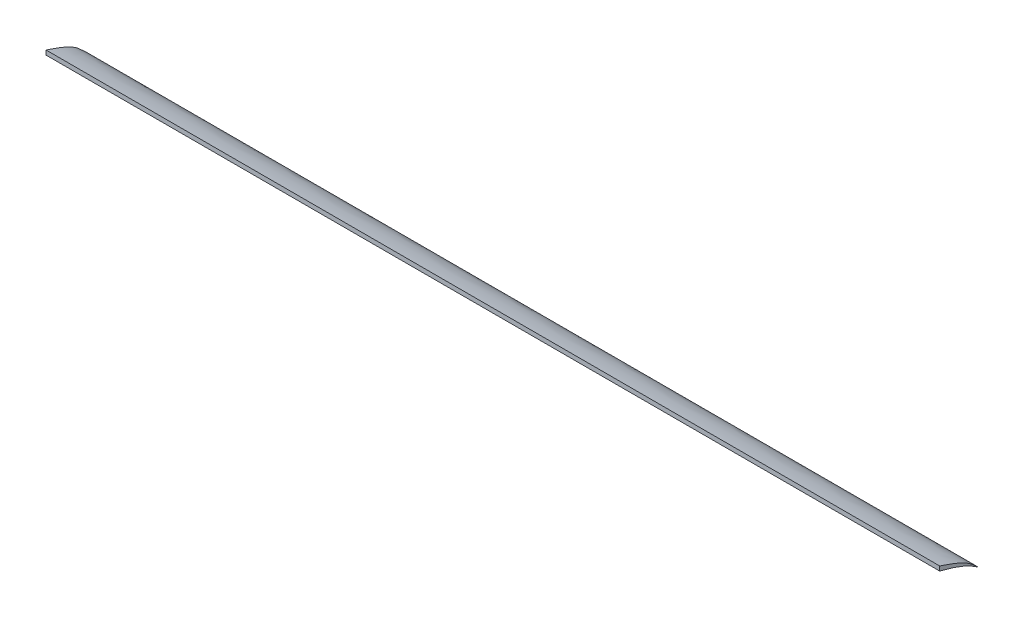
SolidWorks part; units mm, degrees
ref_plane "Front Plane" through (0, 0, 0) normal (0, 0, 1) x (1, 0, 0)
ref_plane "Top Plane" through (0, 0, 0) normal (0, 1, 0) x (1, 0, 0)
ref_plane "Right Plane" through (0, 0, 0) normal (1, 0, 0) x (0, 0, -1)
curve "Curve1"
sketch "Sketch1" plane through (0, 0, 0) normal (1, 0, 0) x (0, 0, -1)
  line L0 (146.05, 0) -> (146.0493, 0) construction
  line L1 (0, 0) -> (0, 95.7684) construction
  line L2 (133.35, 5.1955) -> (133.35, 6.6637)
  spline S0 degree 3 poles (133.35, 5.1955) (133.6733, 5.1158) (135.2776, 4.7104) (137.9247, 3.9519) (141.0213, 2.7951) (143.2305, 1.7366) (144.8593, 0.7581) (145.485, 0.3795) (146.0491, -0.0038) (146.05, 0) (146.0509, 0.0037) (145.5709, 0.3616) (145.165, 0.7601) (144.2637, 1.5926) (143.2004, 2.4782) (141.7457, 3.3711) (139.9367, 4.2365) (137.7528, 5.1399) (135.5147, 5.9531) (134.0028, 6.4545) (133.35, 6.6637) knots 0.954903 0.954903 0.954903 0.954903 0.958169 0.971136 0.981956 0.990252 0.995853 0.999 1 1 1 1.00098 1.003649 1.007483 1.012095 1.017526 1.024052 1.031783 1.040678 1.047399 1.047399 1.047399 1.047399
  dimension "D1" = 146.05
  dimension "D2" = 133.35
extrude "Boss-Extrude1" add sketch "Sketch1" along normal mid plane 295.275
